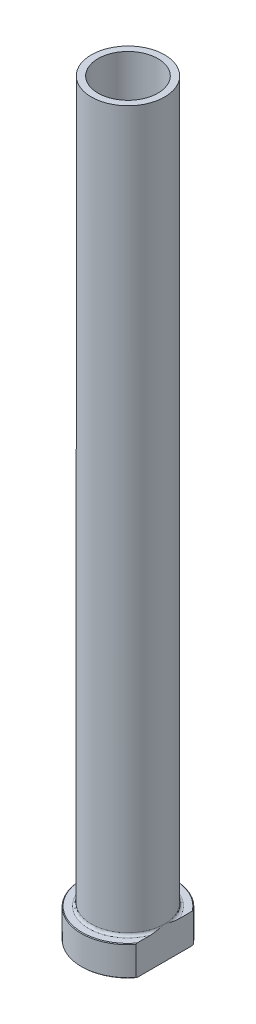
SolidWorks part; units mm, degrees
ref_plane "Front Plane" through (0, 0, 0) normal (0, 0, 1) x (1, 0, 0)
ref_plane "Top Plane" through (0, 0, 0) normal (0, 1, 0) x (1, 0, 0)
ref_plane "Right Plane" through (0, 0, 0) normal (1, 0, 0) x (0, 0, -1)
sketch "Sketch1" plane through (0, 0, 0) normal (0, 0, 1) x (1, 0, 0)
  line L0 (-9, 225) -> (-11, 225)
  line L1 (-11, 225) -> (-11, 9)
  line L2 (-11, 9) -> (-14, 9)
  line L3 (-14, 9) -> (-14, 0)
  line L4 (13.75, 0) -> (-13.75, 0) construction
  line L5 (-14, 0) -> (-9.25, 0)
  line L6 (-9, 170) -> (-9, 225)
  line L7 (0, 92.1877) -> (0, -15.5353) construction
  line L8 (0, -15.4) -> (0, 15.4) construction
  line L9 (-9, 170) -> (-9.25, 158)
  line L10 (-9.25, 158) -> (-9.25, 0)
  dimension "D1" = 0.25
  dimension "ID" = 18
  dimension "OD" = 22
  dimension "L" = 225
  dimension "H" = 28
  dimension "T" = 9
  dimension "N" = 55
  dimension "D2" = 12
  dimension "L-N" = 170
revolve "Revolve1" add sketch "Sketch1" angle 360 about L7
fillet "Fillet1" radius 0.8 1 edges at (0, 9, 11)
chamfer "Chamfer1" distance 0.2 angle 45 2 edges at (0, 9, 14) (0, 0, 14)
sketch "Sketch2" plane through (0, 0, 0) normal (0, -1, 0) x (1, 0, 0)
  line L0 (11, 8.6603) -> (11, -8.6603)
  circle A0 centre (0, 0) radius 14 construction
  arc A1 (11, 8.6603) -> (11, -8.6603) centre (0, 0) cw
  circle A2 centre (0, 0) radius 11 construction
extrude "Cut-Extrude1" cut sketch "Sketch2" against normal through all
chamfer "Chamfer2" distance 0.5 angle 45 1 edges at (0, 0, 9.25)
